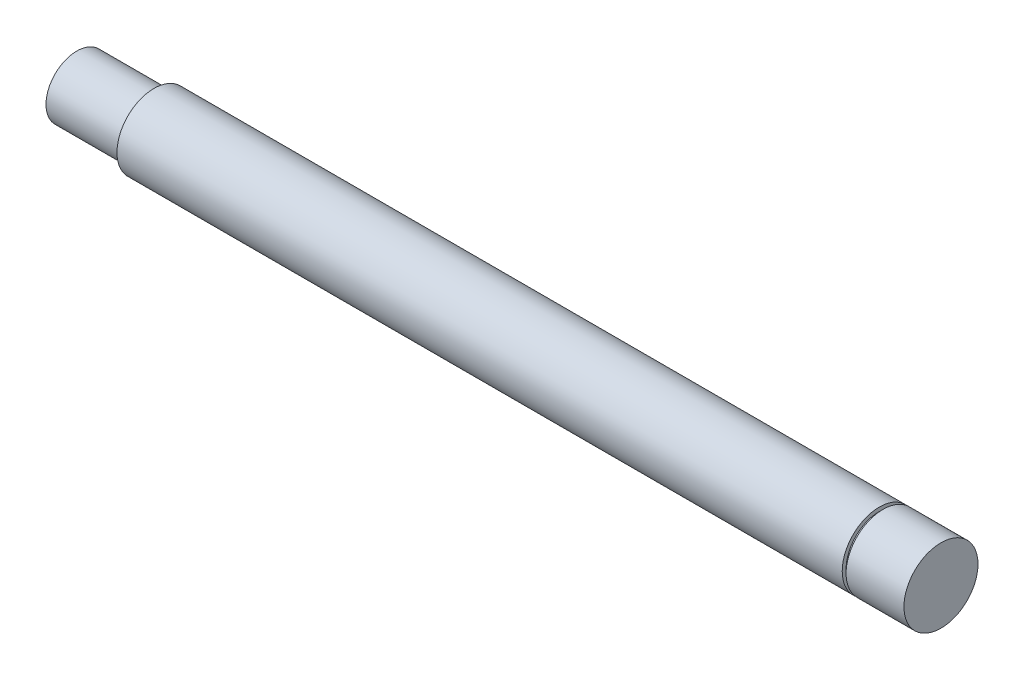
SolidWorks part; units mm, degrees
ref_plane "Front" through (0, 0, 0) normal (0, 0, 1) x (1, 0, 0)
ref_plane "Top" through (0, 0, 0) normal (0, 1, 0) x (1, 0, 0)
ref_plane "Right" through (0, 0, 0) normal (1, 0, 0) x (0, 0, -1)
sketch "Sketch1" plane through (0, 0, 0) normal (1, 0, 0) x (0, 0, -1)
  circle A0 centre (0, 0) radius 7.62
  dimension "D1" = 15.24
extrude "Base-Extrude" add sketch "Sketch1" along normal blind 177.8
ref_plane "Plane4" through (165.8937, 0, 0) normal (1, 0, 0) x (0, 0, -1)
sketch "Sketch2" plane through (165.8937, 0, 0) normal (1, 0, 0) x (0, 0, -1)
  circle A1 centre (0, 0) radius 6.8262
  circle A2 centre (0, 0) radius 6.8262
  circle A3 centre (0, 0) radius 7.62
  circle A4 centre (0, 0) radius 7.62
  dimension "D1" = 0.7937
  dimension "D2" = 0
extrude "Cut-Extrude1" cut sketch "Sketch2" against normal blind 0.7937
sketch "Sketch3" plane through (0, 0, 0) normal (-1, 0, 0) x (0, 0, 1)
  circle A0 centre (0, 0) radius 7.62 construction
  circle A1 centre (0, 0) radius 6.35
  circle A2 centre (0, 0) radius 6.35
  circle A3 centre (0, 0) radius 7.62
  dimension "D1" = 1.27
extrude "Cut-Extrude2" cut sketch "Sketch3" against normal blind 15.875
sketch "Sketch4" plane through (177.8, 0, 0) normal (1, 0, 0) x (0, 0, -1)
  circle A0 centre (0, 0) radius 4.7625
  dimension "D1" = 9.525
extrude "Cut-Extrude3" cut sketch "Sketch4" against normal blind 25.4
